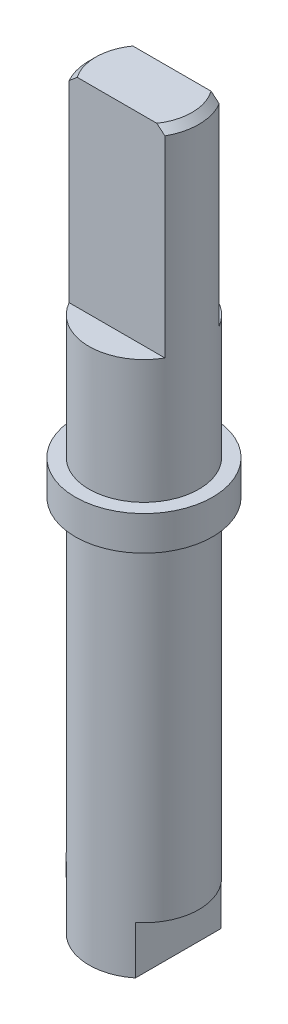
SolidWorks part; units mm, degrees
ref_plane "Front" through (0, 0, 0) normal (0, 0, 1) x (1, 0, 0)
ref_plane "Top" through (0, 0, 0) normal (0, 1, 0) x (1, 0, 0)
ref_plane "Right" through (0, 0, 0) normal (1, 0, 0) x (0, 0, -1)
sketch "Sketch1" plane through (0, 0, 0) normal (0, 1, 0) x (1, 0, 0)
  circle A0 centre (0, 0) radius 8
  dimension "D1" = 16
extrude "Boss-Extrude1" add sketch "Sketch1" along normal mid plane 107
chamfer "Chamfer1" distance 1 angle 45 1 edges at (0, 53.5, 8)
ref_plane "Plane1" through (0, 6.5, 0) normal (0, 1, 0) x (1, 0, 0)
sketch "Sketch2" plane through (0, 6.5, 0) normal (0, 1, 0) x (1, 0, 0)
  circle A0 centre (0, 0) radius 10
  dimension "D1" = 20
extrude "Boss-Extrude2" add sketch "Sketch2" against normal blind 5
sketch "Sketch3" plane through (0, 53.5, 0) normal (0, 1, 0) x (1, 0, 0)
  line L1 (-10.4524, 4.0768) -> (10.8617, 4.0768)
  line L2 (-10.4524, 4.0768) -> (-10.4524, -3.9232)
  line L3 (-10.4524, -3.9232) -> (10.8617, -3.9232)
  line L4 (10.8617, 4.0768) -> (10.8617, -3.9232)
  line L5 (-10.4524, 4.0768) -> (10.8617, -3.9232) construction
  line L6 (-10.4524, -3.9232) -> (10.8617, 4.0768) construction
  point P4 (0.2046, 0.0768)
  dimension "D1" = 8
extrude "Cut-Extrude1" cut sketch "Sketch3" against normal blind 29 flip side to cut
sketch "Sketch4" plane through (0, -53.5, 0) normal (0, -1, 0) x (1, 0, 0)
  line L1 (-5, 14.4051) -> (5, 14.4051)
  line L2 (-5, 14.4051) -> (-5, -14.4051)
  line L3 (-5, -14.4051) -> (5, -14.4051)
  line L4 (5, 14.4051) -> (5, -14.4051)
  line L5 (-5, 14.4051) -> (5, -14.4051) construction
  line L6 (-5, -14.4051) -> (5, 14.4051) construction
  point P4 (0, 0)
  dimension "D1" = 10
extrude "Cut-Extrude2" cut sketch "Sketch4" against normal blind 7 flip side to cut
